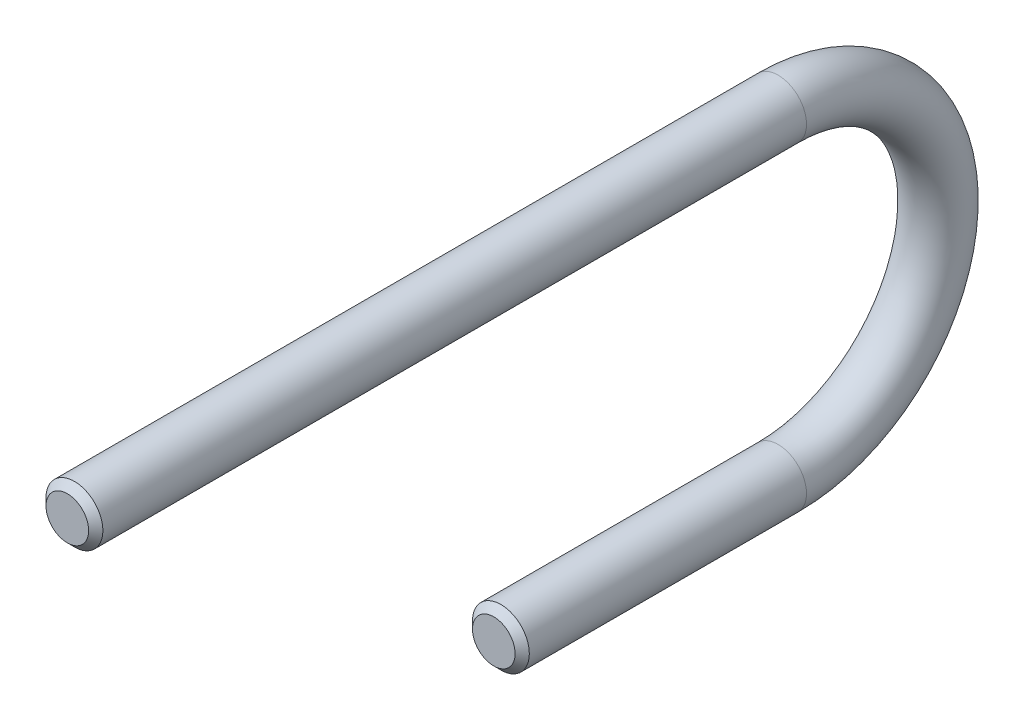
SolidWorks part; units mm, degrees
ref_plane "Front Plane" through (0, 0, 0) normal (0, 0, 1) x (1, 0, 0)
ref_plane "Top Plane" through (0, 0, 0) normal (0, 1, 0) x (1, 0, 0)
ref_plane "Right Plane" through (0, 0, 0) normal (1, 0, 0) x (0, 0, -1)
sketch "Sketch1" plane through (0, 0, 0) normal (1, 0, 0) x (0, 0, -1)
  line L0 (0, 0) -> (40, 0)
  line L1 (40, 45) -> (-60, 45)
  arc A0 (40, 0) -> (40, 45) centre (40, 22.5) ccw
  dimension "D1" = 100
  dimension "D3" = 22.5
  dimension "D2" = 40
sketch "Sketch2" plane through (0, 0, 0) normal (0, 0, 1) x (1, 0, 0)
  circle A0 centre (0, 0) radius 4
sweep "Sweep1" add profiles "Sketch2" path "Sketch1"
chamfer "Chamfer1" distance 1 angle 45 2 edges at (4, 0, 0) (4, 45, 60)
